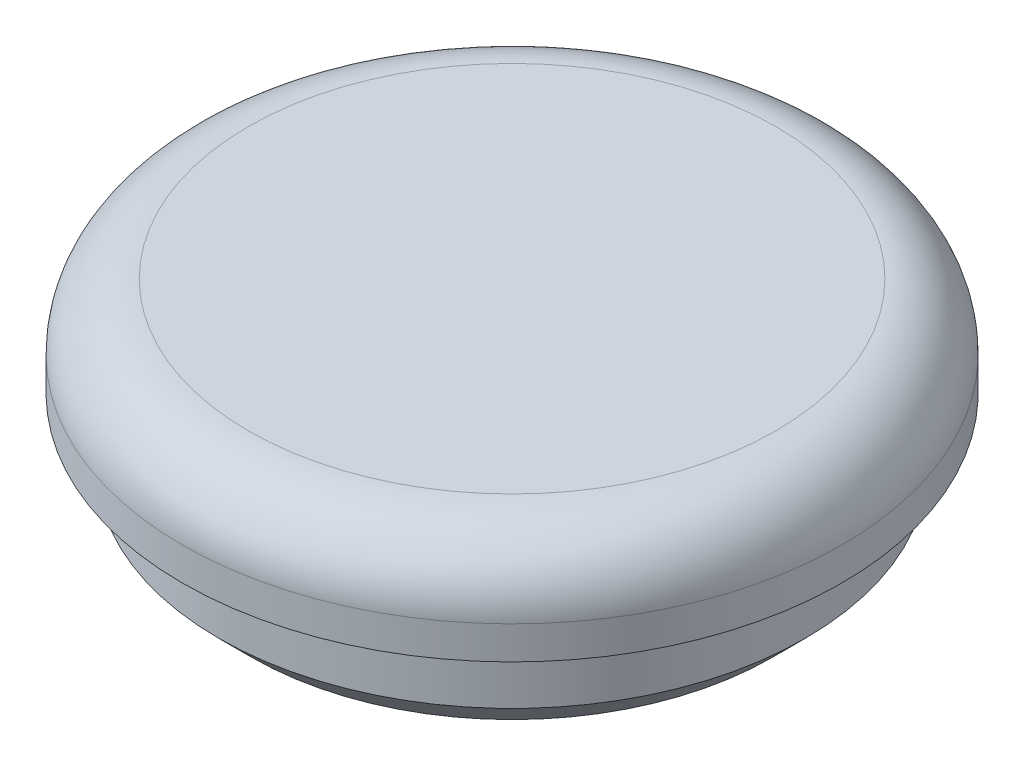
SolidWorks part; units mm, degrees
ref_plane "Plan de face" through (0, 0, 0) normal (0, 0, 1) x (1, 0, 0)
ref_plane "Plan de dessus" through (0, 0, 0) normal (0, 1, 0) x (1, 0, 0)
ref_plane "Plan de droite" through (0, 0, 0) normal (1, 0, 0) x (0, 0, -1)
sketch "Esquisse1" plane through (0, 0, 0) normal (0, 0, 1) x (1, 0, 0)
  line L0 (0, 0) -> (4, 0)
  line L1 (5, -1) -> (5, -1.5)
  line L2 (5, -1.5) -> (4.45, -1.5)
  line L3 (4.45, -1.5) -> (4.45, -2.5)
  line L4 (3.95, -3) -> (0, -3)
  line L5 (0, 5.0365) -> (0, -8.4307) construction
  line L6 (4.45, -2.5) -> (3.95, -3)
  line L7 (0, 0) -> (0, -3)
  arc A0 (4, 0) -> (5, -1) centre (4, -1) cw
  point P6 (4.45, -3)
  dimension "D5" = 1
  dimension "D1" = 5
  dimension "D2" = 8.9
  dimension "D3" = 1.5
  dimension "D4" = 1.5
revolve "Révolution1" add sketch "Esquisse1" angle 360 about L5
